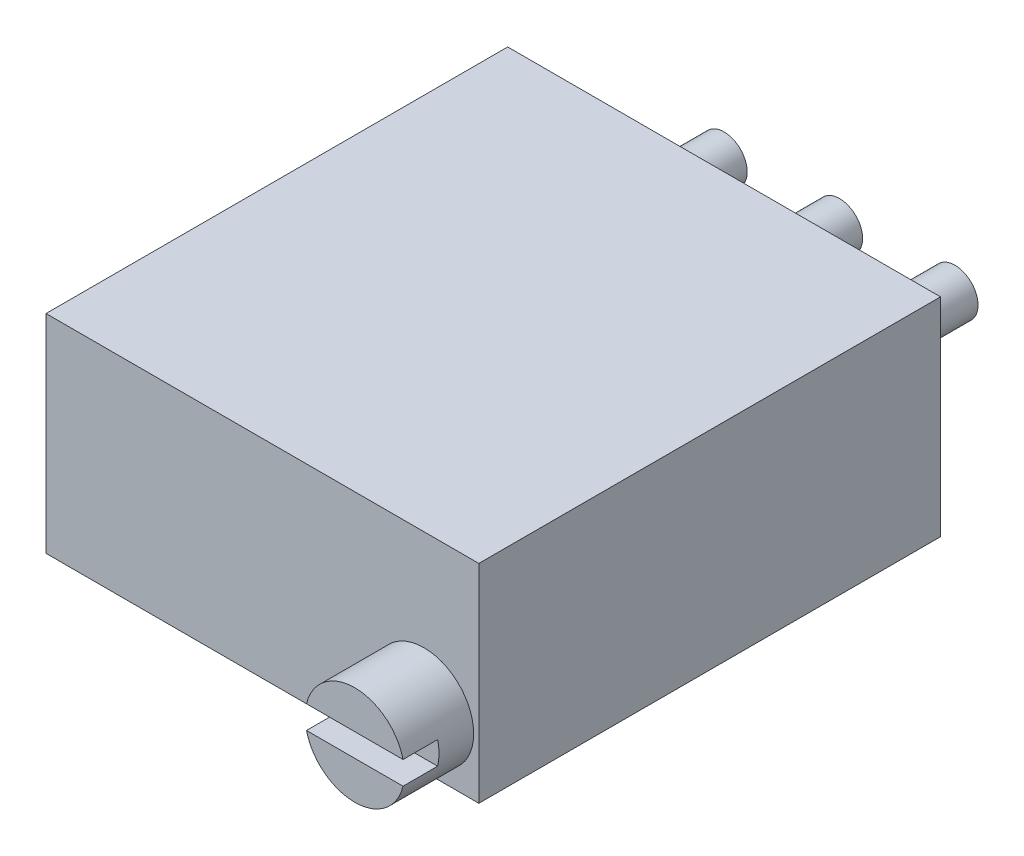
SolidWorks part; units mm, degrees
ref_plane "Front Plane" through (0, 0, 0) normal (0, 0, 1) x (1, 0, 0)
ref_plane "Top Plane" through (0, 0, 0) normal (0, 1, 0) x (1, 0, 0)
ref_plane "Right Plane" through (0, 0, 0) normal (1, 0, 0) x (0, 0, -1)
sketch "Sketch1" plane through (0, 0, 0) normal (0, 0, 1) x (1, 0, 0)
  line L1 (-4.7625, 2.286) -> (4.7625, 2.286)
  line L2 (-4.7625, 2.286) -> (-4.7625, -2.286)
  line L3 (-4.7625, -2.286) -> (4.7625, -2.286)
  line L4 (4.7625, 2.286) -> (4.7625, -2.286)
extrude "Boss-Extrude1" add sketch "Sketch1" along normal blind 10.16
sketch "Sketch2" plane through (0, 0, 0) normal (0, 0, -1) x (-1, 0, 0)
  circle A0 centre (2.54, 0) radius 0.508
  circle A1 centre (-2.54, 0) radius 0.508
  circle A2 centre (0, 0) radius 0.508
extrude "Boss-Extrude2" add sketch "Sketch2" along normal blind 2.54 separate body
sketch "Sketch3" plane through (0, 0, 10.16) normal (0, 0, 1) x (1, 0, 0)
  circle A0 centre (3.556, -1.016) radius 1.0922
extrude "Boss-Extrude3" add sketch "Sketch3" along normal blind 1.524 separate body
sketch "Sketch4" plane through (0, 0, 11.684) normal (0, 0, 1) x (1, 0, 0)
  line L1 (2.4638, -0.762) -> (4.6482, -0.762)
  line L2 (2.4638, -0.762) -> (2.4638, -1.27)
  line L3 (2.4638, -1.27) -> (4.6482, -1.27)
  line L4 (4.6482, -0.762) -> (4.6482, -1.27)
extrude "Cut-Extrude1" cut sketch "Sketch4" against normal blind 0.762
